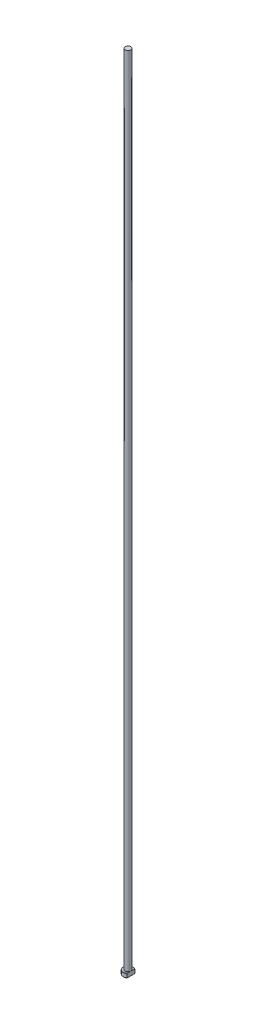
SolidWorks part; units mm, degrees
ref_plane "Front Plane" through (0, 0, 0) normal (0, 0, 1) x (1, 0, 0)
ref_plane "Top Plane" through (0, 0, 0) normal (0, 1, 0) x (1, 0, 0)
ref_plane "Right Plane" through (0, 0, 0) normal (1, 0, 0) x (0, 0, -1)
sketch "Sketch1" plane through (0, 0, 0) normal (0, 0, 1) x (1, 0, 0)
  line L0 (0, 259.9588) -> (0, -15.1925) construction
  line L1 (0, 0) -> (-6, 0)
  line L2 (-6, 0) -> (-6, 5)
  line L3 (-6, 5) -> (-3.5, 5)
  line L4 (-3.5, 5) -> (-3.5, 1000)
  line L5 (-3.5, 1000) -> (0, 1000)
  line L6 (0, 1000) -> (0, 0)
  dimension "L" = 1000
  dimension "H" = 12
  dimension "T" = 5
  dimension "D" = 7
revolve "Revolve1" add sketch "Sketch1" angle 360 about L0
chamfer "Chamfer1" distance 0.2 angle 45 2 edges at (0, 5, 6) (0, 0, 6)
fillet "Fillet1" radius 0.2 1 edges at (0, 5, 3.5)
sketch "Sketch2" plane through (0, 0, 0) normal (0, 1, 0) x (1, 0, 0)
  line L0 (3.5, 4.8734) -> (3.5, -4.8734)
  circle A0 centre (0, 0) radius 6 construction
  arc A1 (3.5, -4.8734) -> (3.5, 4.8734) centre (0, 0) ccw
  circle A2 centre (0, 0) radius 3.5 construction
extrude "KEY" cut sketch "Sketch2" along normal through all
